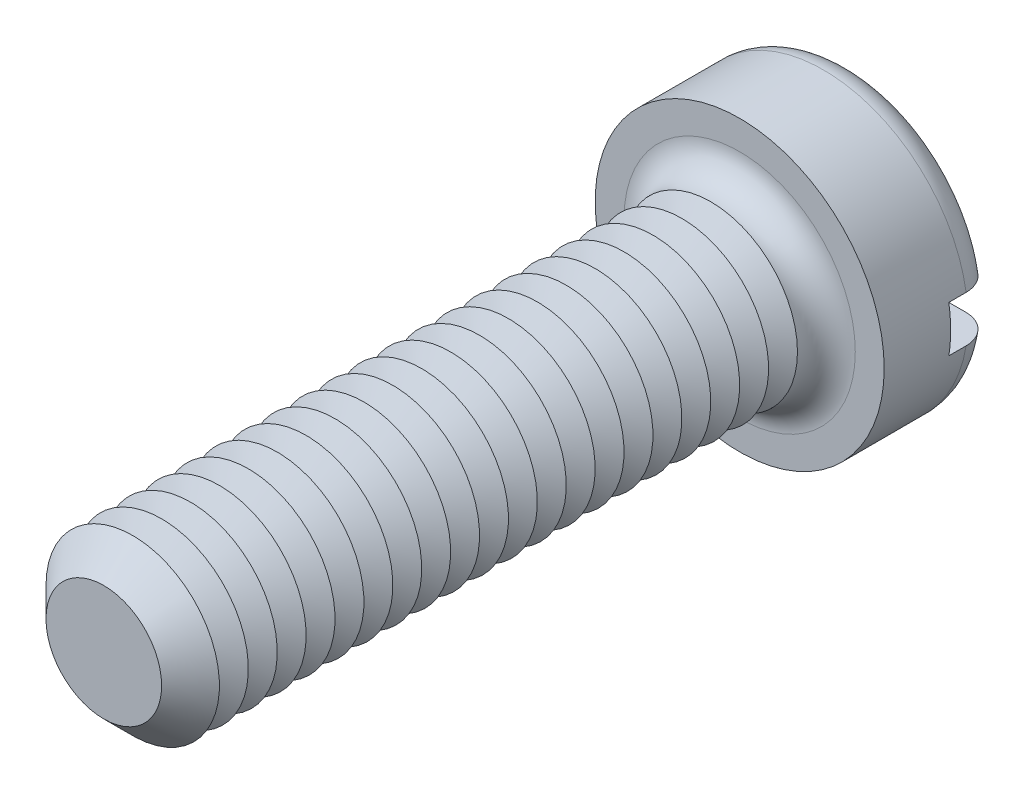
SolidWorks part; units mm, degrees
ref_plane "Front Plane" through (0, 0, 0) normal (0, 0, 1) x (1, 0, 0)
ref_plane "Top Plane" through (0, 0, 0) normal (0, 1, 0) x (1, 0, 0)
ref_plane "Right Plane" through (0, 0, 0) normal (1, 0, 0) x (0, 0, -1)
sketch "Sketch3" plane through (0, 0, 0) normal (0, 0, 1) x (1, 0, 0)
  circle A0 centre (0, 0) radius 5
  dimension "D1" = 10
extrude "Boss-Extrude2" add sketch "Sketch3" against normal blind 3.9
sketch "Sketch4" plane through (0, 0, 0) normal (0, 0, 1) x (1, 0, 0)
  circle A0 centre (0, 0) radius 3
  dimension "D1" = 6
extrude "Boss-Extrude3" add sketch "Sketch4" along normal blind 22
fillet "Fillet1" radius 1 2 edges at (5, 0, -3.9) (3, 0, 0)
chamfer "Chamfer1" distance 1 angle 45 1 edges at (3, 0, 22)
sketch "Sketch5" plane through (0, 0, 0) normal (1, 0, 0) x (0, 0, -1)
  line L0 (1.6944, 0) -> (-7.6738, 0) construction
sketch "Sketch6" plane through (0, 0, 0) normal (1, 0, 0) x (0, 0, -1)
  line L0 (-1, 3) -> (-1.5, 2.134)
  line L1 (-1.5, 2.134) -> (-2, 3)
  line L2 (-1, 3) -> (-21, 3) construction
  line L3 (-2, 3) -> (-1, 3)
  dimension "D1" = 1
revolve "Cut-Revolve1" cut sketch "Sketch6" angle 360 about L0
pattern_linear "LPattern1" count 20 spacing 1 along (0, 0, 1) of "Cut-Revolve1"
sketch "Sketch8" plane through (0, 0, -3.9) normal (0, 0, -1) x (-1, 0, 0)
  line L1 (5, -0.8) -> (-5, -0.8)
  line L2 (5, -0.8) -> (5, 0.8)
  line L3 (5, 0.8) -> (-5, 0.8)
  line L4 (-5, -0.8) -> (-5, 0.8)
  line L5 (5, -0.8) -> (-5, 0.8) construction
  line L6 (5, 0.8) -> (-5, -0.8) construction
  point P0 (0, 0)
  dimension "D1" = 10
  dimension "D2" = 1.6
extrude "Cut-Extrude1" cut sketch "Sketch8" against normal blind 1.6
